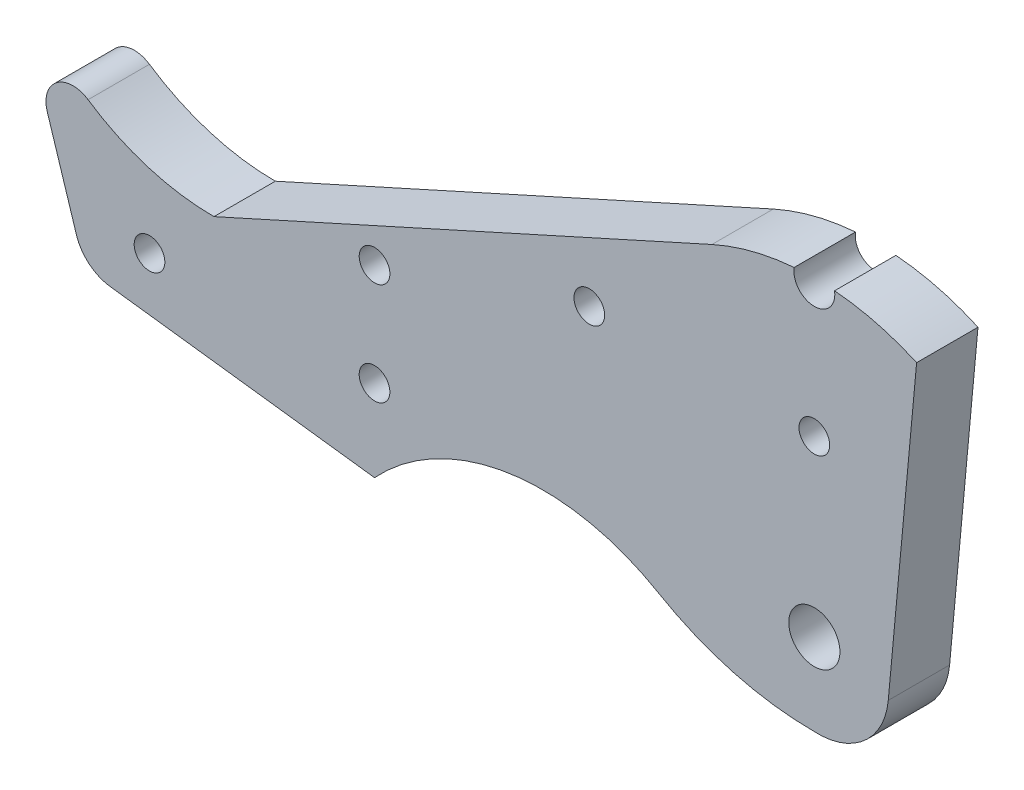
SolidWorks part; units mm, degrees
ref_plane "Front" through (0, 0, 0) normal (0, 0, 1) x (1, 0, 0)
ref_plane "Top" through (0, 0, 0) normal (0, 1, 0) x (1, 0, 0)
ref_plane "Right" through (0, 0, 0) normal (1, 0, 0) x (0, 0, -1)
sketch "Sketch1" plane through (0, 0, 0) normal (0, 0, 1) x (1, 0, 0)
  line L11 (85, 36.2399) -> (82.2266, 6.2575)
  line L12 (32, 0) -> (6.1464, 3.2593)
  line L13 (2.7734, 6.2575) -> (0, 15.0024)
  line L14 (16.3045, 14.2563) -> (64.9868, 36.2399)
  arc A0 (73.0249, 38.3146) -> (76.9753, 38.3136) centre (75, 38) ccw
  circle A1 centre (75, 25) radius 1.5
  circle A2 centre (75, 8) radius 2.5
  circle A3 centre (53, 25) radius 1.5
  circle A4 centre (32, 18) radius 1.5
  circle A5 centre (32, 8) radius 1.5
  circle A6 centre (10, 8) radius 1.5
  arc A7 (82.2266, 6.2575) -> (75, 0) centre (75.3537, 6.8932) cw
  arc A8 (75, 0) -> (59.7399, 4.1337) centre (75, 30.2341) cw
  arc A9 (59.7399, 4.1337) -> (32, 0) centre (48.4416, -15.1904) ccw
  arc A10 (6.1464, 3.2593) -> (2.7734, 6.2575) centre (6.6453, 7.217) cw
  arc A11 (0, 15.0024) -> (3.9951, 18) centre (2.522, 15.8022) cw
  arc A12 (3.9951, 18) -> (16.3045, 14.2563) centre (16.3045, 36.3651) ccw
  arc A13 (64.9868, 36.2399) -> (73.0249, 38.3146) centre (74.9934, 14.0803) cw
  arc A14 (76.9753, 38.3136) -> (85, 36.2399) centre (74.9934, 14.0803) cw
extrude "Extrude1" add sketch "Sketch1" along normal blind 6
